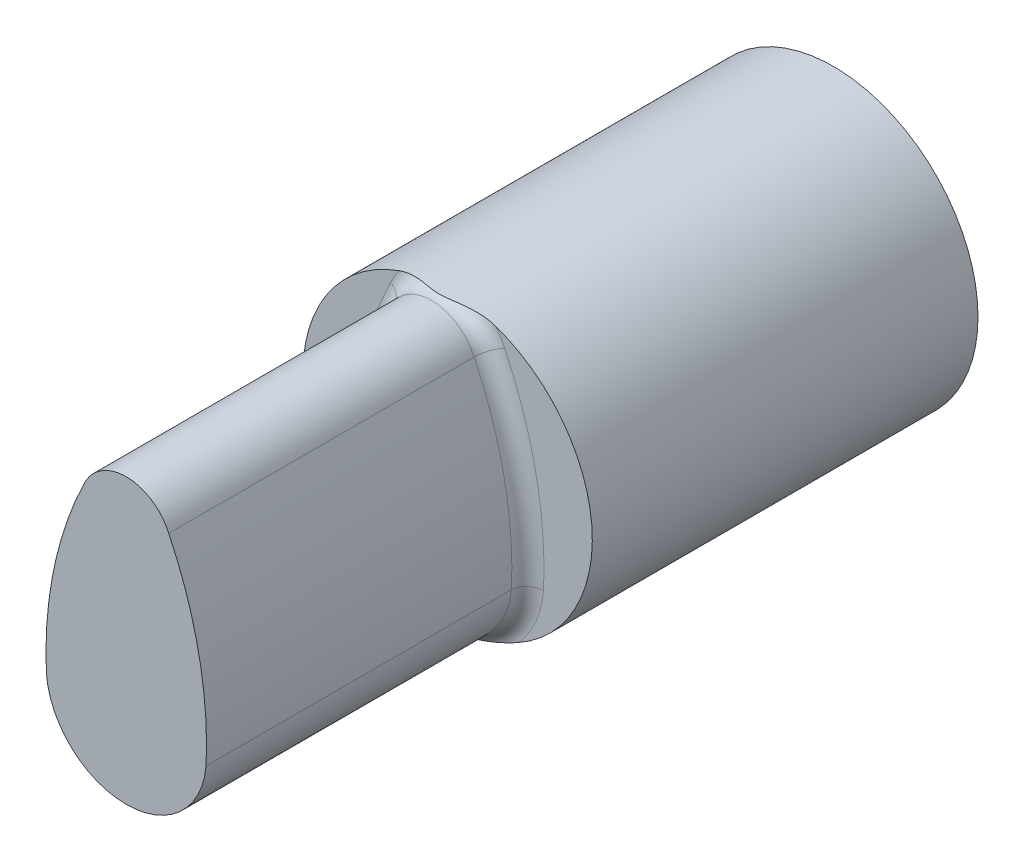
SolidWorks part; units mm, degrees
ref_plane "Front Plane" through (0, 0, 0) normal (0, 0, 1) x (1, 0, 0)
ref_plane "Top Plane" through (0, 0, 0) normal (0, 1, 0) x (1, 0, 0)
ref_plane "Right Plane" through (0, 0, 0) normal (1, 0, 0) x (0, 0, -1)
sketch "Sketch1" plane through (0, 0, 0) normal (0, 0, 1) x (1, 0, 0)
  circle A0 centre (0, 0) radius 28.575
  dimension "D1" = 57.15
extrude "Boss-Extrude1" add sketch "Sketch1" along normal blind 76.2
sketch "Sketch2" plane through (0, 0, 76.2) normal (0, 0, 1) x (1, 0, 0)
  line L0 (0, 19.0454) -> (0, -12.0262) construction
  line L1 (0, 31.4609) -> (0, -37.3938)
  line L2 (-24.7574, 0) -> (23.382, 0) construction
  arc A0 (8.3952, 22.7168) -> (-8.3952, 22.7168) centre (0, 19.0454) ccw
  arc A1 (-15.773, -13.4016) -> (15.773, -13.4016) centre (0, -12.0262) ccw
  arc A2 (-8.3952, 22.7168) -> (-15.773, -13.4016) centre (59.0339, -9.8694) ccw
  arc A3 (8.3952, 22.7168) -> (15.773, -13.4016) centre (-59.0339, -9.8694) cw
extrude "Boss-Extrude2" add sketch "Sketch2" along normal blind 63.5 contours A0 A2 A1 L1 | A3 A0 L1 A1
fillet "Fillet2" radius 3.175 4 edges at (0, 28.2083, 76.2) (-14.3412, 5.1186, 76.2) (0, -27.8591, 76.2) (14.3412, 5.1186, 76.2)
